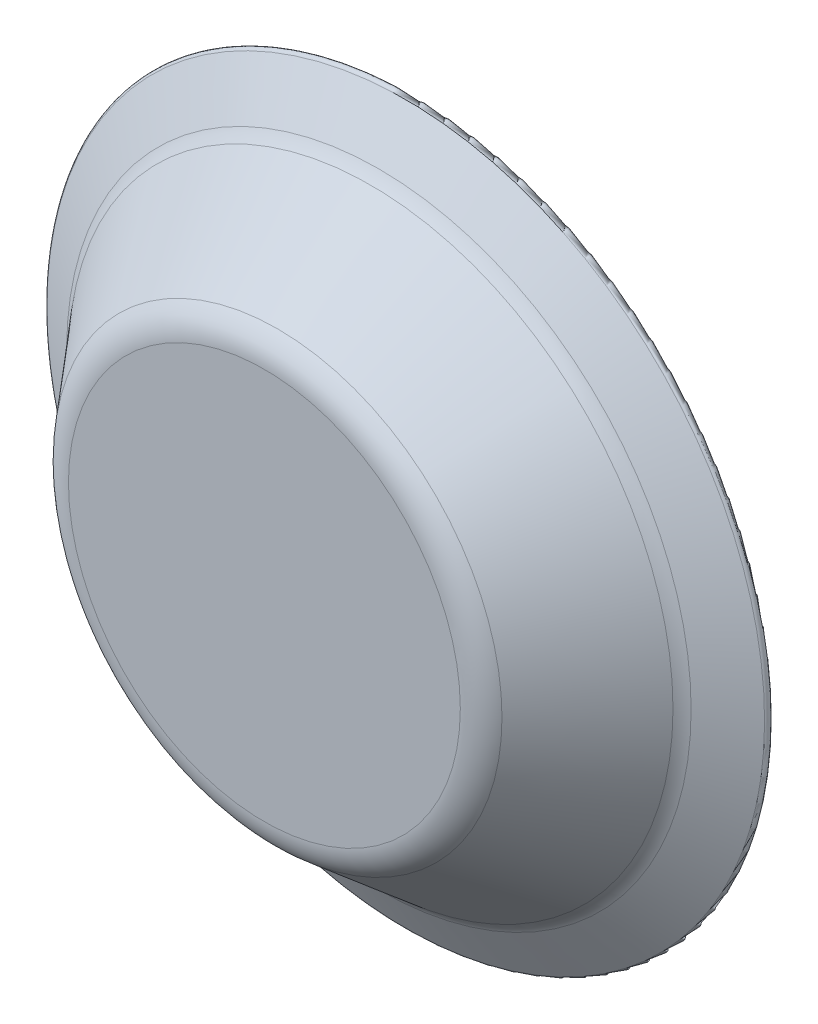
SolidWorks part; units mm, degrees
ref_plane "Front Plane" through (0, 0, 0) normal (0, 0, 1) x (1, 0, 0)
ref_plane "Top Plane" through (0, 0, 0) normal (0, 1, 0) x (1, 0, 0)
ref_plane "Right Plane" through (0, 0, 0) normal (1, 0, 0) x (0, 0, -1)
sketch "Sketch1" plane through (0, 0, 0) normal (0, 0, 1) x (1, 0, 0)
  circle A0 centre (0, 0) radius 100
  dimension "D1" = 200
extrude "Boss-Extrude1" add sketch "Sketch1" along normal blind 10 draft 60
sketch "Sketch2" plane through (0, 0, 0) normal (0, 0, -1) x (-1, 0, 0)
  circle A1 centre (0, 0) radius 100
  circle A2 centre (0, 0) radius 100
  circle A3 centre (0, 0) radius 82.6795
  circle A4 centre (0, 0) radius 82.6795
  dimension "D1" = 0
  dimension "D2" = 0
sketch "Sketch6" plane through (0, 0, 10) normal (0, 0, 1) x (1, 0, 0)
  circle A0 centre (0, 0) radius 82.6795
extrude "Boss-Extrude4" add sketch "Sketch6" along normal blind 30 draft 40
fillet "Fillet1" radius 1 1 edges at (100, 0, 0)
fillet "Fillet2" radius 10 2 edges at (57.5065, 0, 40) (82.6795, 0, 10)
shell "Shell1" thickness 10
